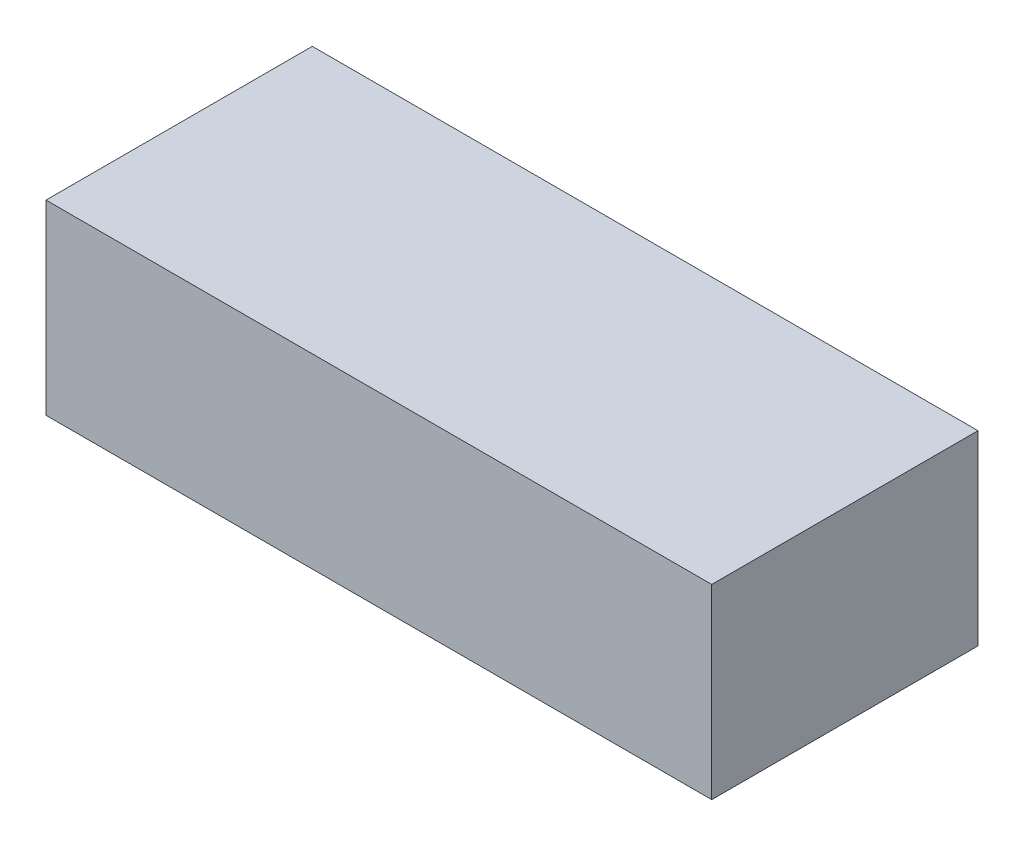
SolidWorks part; units mm, degrees
ref_plane "前视基准面" through (0, 0, 0) normal (0, 0, 1) x (1, 0, 0)
ref_plane "上视基准面" through (0, 0, 0) normal (0, 1, 0) x (1, 0, 0)
ref_plane "右视基准面" through (0, 0, 0) normal (1, 0, 0) x (0, 0, -1)
other "Configuration Table"
sketch "草图1" plane through (0, 0, 0) normal (0, 0, 1) x (1, 0, 0)
  line L1 (-62.5, 17.5) -> (62.5, 17.5)
  line L2 (-62.5, 17.5) -> (-62.5, -17.5)
  line L3 (-62.5, -17.5) -> (62.5, -17.5)
  line L4 (62.5, 17.5) -> (62.5, -17.5)
  line L5 (-62.5, 17.5) -> (62.5, -17.5) construction
  line L6 (-62.5, -17.5) -> (62.5, 17.5) construction
  point P0 (0, 0)
  dimension "D1" = 125
  dimension "D2" = 35
extrude "凸台-拉伸1" add sketch "草图1" along normal blind 50
